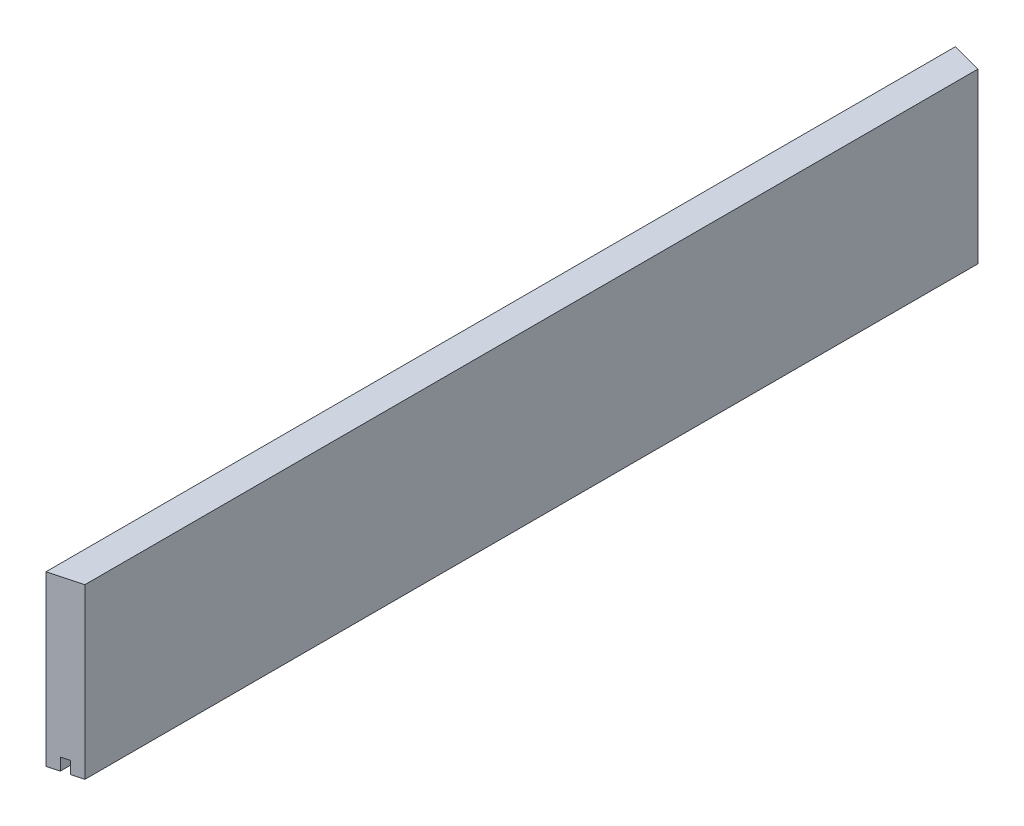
SolidWorks part; units mm, degrees
ref_plane "Plan de face" through (0, 0, 0) normal (0, 0, 1) x (1, 0, 0)
ref_plane "Plan de dessus" through (0, 0, 0) normal (0, 1, 0) x (1, 0, 0)
ref_plane "Plan de droite" through (0, 0, 0) normal (1, 0, 0) x (0, 0, -1)
sketch "Esquisse1" plane through (0, 0, 0) normal (0, 0, 1) x (1, 0, 0)
  line L1 (-7.5, 41.25) -> (7.5, 41.25)
  line L2 (-7.5, 41.25) -> (-7.5, -41.25)
  line L3 (-7.5, -41.25) -> (7.5, -41.25)
  line L4 (7.5, 41.25) -> (7.5, -41.25)
  line L5 (-7.5, 41.25) -> (7.5, -41.25) construction
  line L6 (-7.5, -41.25) -> (7.5, 41.25) construction
  line L7 (-2, -35.25) -> (2, -35.25)
  line L8 (-2, -35.25) -> (-2, -47.25)
  line L9 (-2, -47.25) -> (2, -47.25)
  line L10 (2, -35.25) -> (2, -47.25)
  line L11 (-2, -35.25) -> (2, -47.25) construction
  line L12 (-2, -47.25) -> (2, -35.25) construction
  point P0 (0, 0)
  point P5 (0, -41.25)
  dimension "D1" = 82.5
  dimension "D2" = 15
  dimension "D3" = 12
  dimension "D4" = 4
extrude "Boss.-Extru.1" add sketch "Esquisse1" along normal blind 445 contours L7 L10 L3 L4 L1 L2 L8
sketch "Esquisse2" plane through (0, 0, 0) normal (0, 1, 0) x (1, 0, 0)
  line L0 (-7.5, 0) -> (7.5, 0)
  line L1 (7.5, 0) -> (7.5, -4.0192)
  line L2 (7.5, -445) -> (7.5, 0) construction
  line L3 (7.5, -4.0192) -> (-7.5, 0)
  line L4 (-7.5, -445) -> (7.5, -445)
  line L5 (7.5, -445) -> (7.5, -440.9808)
  line L6 (7.5, -440.9808) -> (-7.5, -445)
  arc A0 (2, 0) -> (1.6763, -2.4588) centre (-7.5, 0) cw
  arc A1 (-1.2295, -445) -> (-1.4432, -443.3771) centre (-7.5, -445) ccw
extrude "Enlèv. mat.-Extru.1" cut sketch "Esquisse2" against normal through all both and the other way through all contours L3 L0 L1 | L6 L4 L5
